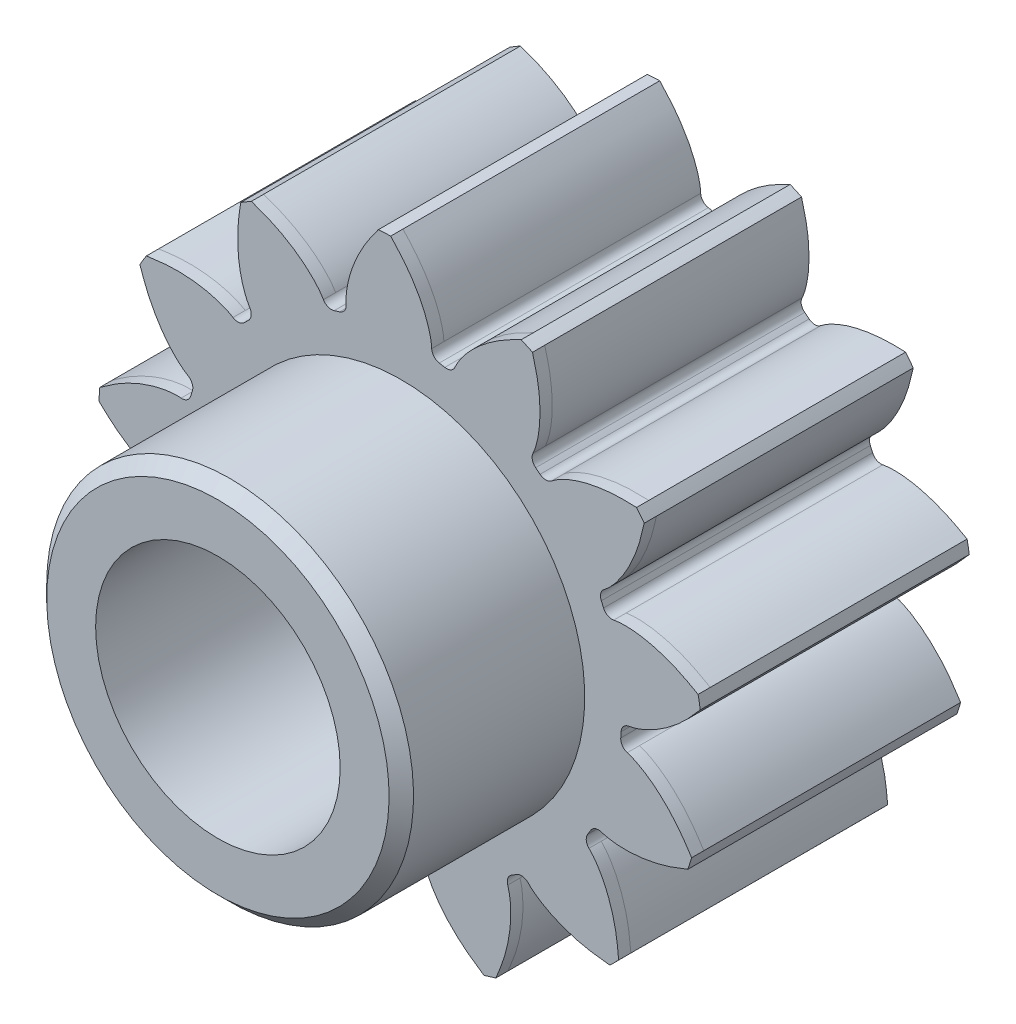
SolidWorks part; units mm, degrees
ref_plane "Face" through (0, 0, 0) normal (0, 0, 1) x (1, 0, 0)
ref_plane "Dessus" through (0, 0, 0) normal (0, 1, 0) x (1, 0, 0)
ref_plane "Droite" through (0, 0, 0) normal (1, 0, 0) x (0, 0, -1)
imported_body "Importée1"
sketch "Esquisse1" plane through (0, 0, 0) normal (0, 0, -1) x (-1, 0, 0)
  circle A0 centre (0, 0) radius 2.0355
  dimension "D1" = 4.071
surface "Surface-primitive" sketch "Esquisse1"
